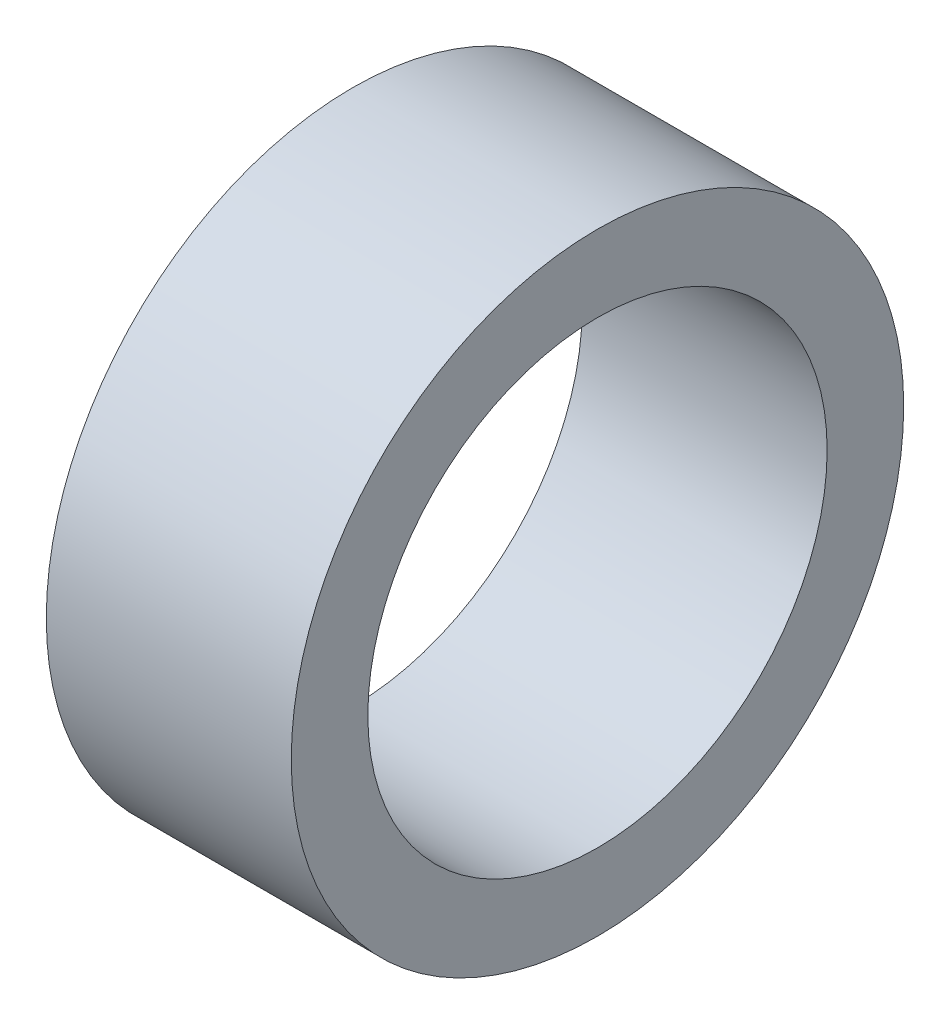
SolidWorks part; units mm, degrees
ref_plane "Plan1" through (0, 0, 0) normal (0, 0, 1) x (1, 0, 0)
ref_plane "Plan2" through (0, 0, 0) normal (0, 1, 0) x (1, 0, 0)
ref_plane "Plan3" through (0, 0, 0) normal (1, 0, 0) x (0, 0, -1)
sketch "Esquisse1" plane through (0, 0, 0) normal (0, 0, 1) x (1, 0, 0)
  line L0 (0, 0) -> (8, 0) construction
  line L1 (0, 10) -> (8, 10)
  line L2 (0, 10) -> (0, 7.5)
  line L3 (0, 7.5) -> (8, 7.5)
  line L4 (8, 10) -> (8, 7.5)
  dimension "D1" = 8
  dimension "D2" = 20
  dimension "D3" = 15
revolve "Base-Révolution" add sketch "Esquisse1" angle 360 about L0
